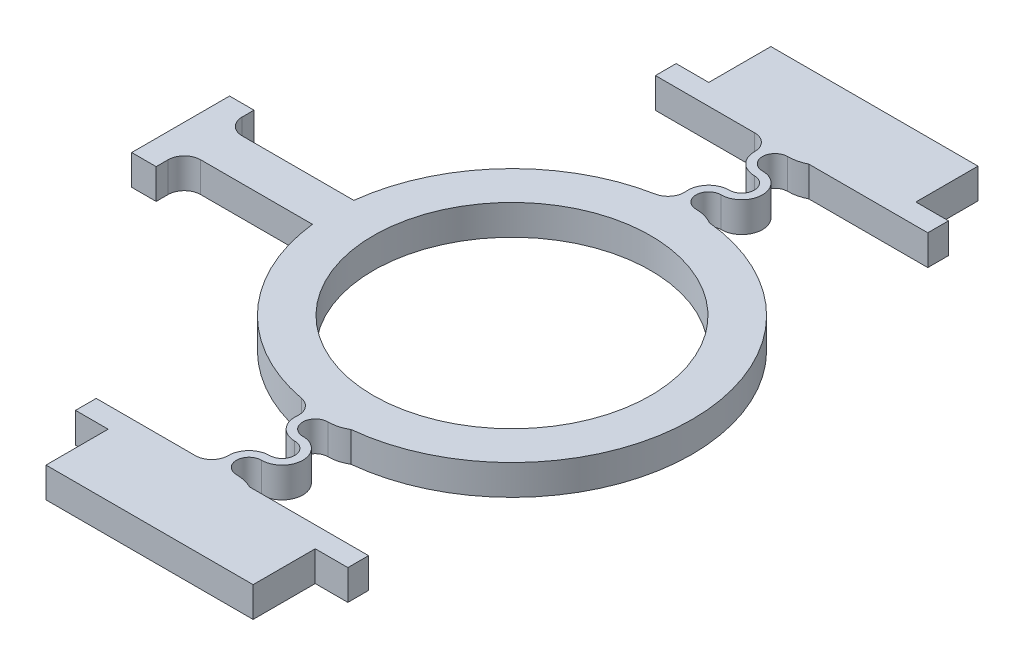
SolidWorks part; units mm, degrees
ref_plane "Front Plane" through (0, 0, 0) normal (0, 0, 1) x (1, 0, 0)
ref_plane "Top Plane" through (0, 0, 0) normal (0, 1, 0) x (1, 0, 0)
ref_plane "Right Plane" through (0, 0, 0) normal (1, 0, 0) x (0, 0, -1)
sketch "Sketch1" plane through (0, 0, 0) normal (0, 1, 0) x (1, 0, 0)
  line L5 (0, 19.685) -> (0, -19.685) construction
  line L7 (-0.2528, -17.145) -> (0.2528, -17.145)
  line L8 (-0.2528, -17.145) -> (-0.2528, -11.0371)
  line L9 (-0.2528, -11.0371) -> (0.2528, -11.0371)
  line L10 (0.2528, -17.145) -> (0.2528, -11.0371)
  line L11 (-0.2528, -17.145) -> (0.2528, -11.0371) construction
  line L12 (-0.2528, -11.0371) -> (0.2528, -17.145) construction
  line L13 (-6.35, 22.225) -> (6.35, 22.225)
  line L14 (-6.35, 22.225) -> (-6.35, 17.145)
  line L15 (-6.35, 17.145) -> (6.35, 17.145)
  line L16 (6.35, 22.225) -> (6.35, 17.145)
  line L17 (-6.35, 22.225) -> (6.35, 17.145) construction
  line L18 (-6.35, 17.145) -> (6.35, 22.225) construction
  line L19 (-6.35, -17.145) -> (6.35, -17.145)
  line L20 (-6.35, -17.145) -> (-6.35, -22.225)
  line L21 (-6.35, -22.225) -> (6.35, -22.225)
  line L22 (6.35, -17.145) -> (6.35, -22.225)
  line L23 (-6.35, -17.145) -> (6.35, -22.225) construction
  line L24 (-6.35, -22.225) -> (6.35, -17.145) construction
  line L25 (-20.32, 1.27) -> (-10.9667, 1.27)
  line L26 (-20.32, 1.27) -> (-20.32, -1.27)
  line L27 (-20.32, -1.27) -> (-10.9667, -1.27)
  line L28 (-10.9667, 1.27) -> (-10.9667, -1.27)
  line L29 (-20.32, 1.27) -> (-10.9667, -1.27) construction
  line L30 (-20.32, -1.27) -> (-10.9667, 1.27) construction
  circle A0 centre (0, 0) radius 8.5
  circle A1 centre (0, 0) radius 11.04
  arc A2 (0, 11.04) -> (0, 13.075) centre (0, 12.0575) cw construction
  arc A3 (0, 13.075) -> (0, 15.11) centre (0, 14.0925) ccw construction
  arc A10 (0, 15.11) -> (0, 17.145) centre (0, 16.1275) cw construction
  arc A11 (0, 11.29) -> (0, 12.825) centre (0, 12.0575) cw
  arc A12 (0, 12.825) -> (0, 15.36) centre (0, 14.0925) ccw
  arc A13 (0, 15.36) -> (0, 16.895) centre (0, 16.1275) cw
  arc A14 (-0.7228, 11.0163) -> (0, 13.325) centre (0, 12.0575) cw
  arc A15 (0, 13.325) -> (0, 14.86) centre (0, 14.0925) ccw
  arc A16 (0, 14.86) -> (-0.7558, 17.145) centre (0, 16.1275) cw
  arc A17 (0, 16.895) -> (1.0544, 17.145) centre (0, 19.2434) ccw
  arc A18 (0, 11.29) -> (1.1156, 10.9835) centre (0, 9.1065) cw
  arc A19 (0, 14.86) -> (0, 17.395) centre (0, 16.1275) cw construction
  arc A20 (0, 10.79) -> (0, 13.325) centre (0, 12.0575) cw construction
  point P9 (0, -14.0911)
  point P14 (0, 19.685)
  point P19 (0, -19.685)
  point P24 (-15.6434, 0)
  dimension "D1" = 17
  dimension "D2" = 2.54
  dimension "D3" = 0.25
  dimension "D4" = 12.7
  dimension "D5" = 5.08
  dimension "D6" = 44.45
  dimension "D7" = 2.54
  dimension "D8" = 20.32
  dimension "D9" = 0.25
sketch "Sketch2" plane through (0, 0, 0) normal (0, 1, 0) x (1, 0, 0)
  line L12 (-10.9667, 1.27) -> (-20.32, 1.27)
  line L13 (-10.9667, -1.27) -> (-10.9667, 1.27)
  line L14 (-20.32, -1.27) -> (-10.9667, -1.27)
  line L15 (-20.32, 1.27) -> (-20.32, -1.27)
  line L16 (-10.9667, 1.27) -> (-20.32, 1.27)
  line L18 (-20.32, -1.27) -> (-10.9667, -1.27)
  line L19 (-20.32, 1.27) -> (-20.32, -1.27)
  circle A2 centre (0, 0) radius 11.04
  arc A3 (-10.9667, -1.27) -> (-10.9667, 1.27) centre (0, 0) ccw
  circle A4 centre (0, 0) radius 8.5
  circle A10 centre (0, 0) radius 8.5
  dimension "D1" = 0
  dimension "D2" = 0
  dimension "D4" = 0
extrude "Boss-Extrude1" add sketch "Sketch2" along normal mid plane 1.85
sketch "Sketch7" plane through (0, 0.925, 0) normal (0, 1, 0) x (1, 0, 0)
  line L0 (1.0544, 17.145) -> (6.35, 17.145)
  line L28 (6.35, 22.225) -> (-6.35, 22.225)
  line L29 (6.35, 17.145) -> (6.35, 22.225)
  line L30 (-6.35, 17.145) -> (6.35, 17.145)
  line L31 (-6.35, 22.225) -> (-6.35, 17.145)
  line L32 (6.35, 22.225) -> (-6.35, 22.225)
  line L33 (6.35, 17.145) -> (6.35, 22.225)
  line L34 (-6.35, 17.145) -> (-0.7558, 17.145)
  line L35 (-6.35, 22.225) -> (-6.35, 17.145)
  arc A2 (0, 13.325) -> (-0.7228, 11.0163) centre (0, 12.0575) ccw construction
  circle A3 centre (0, 0) radius 11.04
  arc A4 (1.1156, 10.9835) -> (-0.7228, 11.0163) centre (0, 0) ccw
  arc A12 (0, 13.325) -> (0, 14.86) centre (0, 14.0925) ccw construction
  arc A13 (-0.7558, 17.145) -> (0, 14.86) centre (0, 16.1275) ccw construction
  arc A14 (0, 16.895) -> (1.0544, 17.145) centre (0, 19.2434) ccw construction
  arc A15 (0, 16.895) -> (0, 15.36) centre (0, 16.1275) ccw construction
  arc A16 (0, 12.825) -> (0, 15.36) centre (0, 14.0925) ccw construction
  arc A17 (0, 12.825) -> (0, 11.29) centre (0, 12.0575) ccw construction
  arc A18 (1.1156, 10.9835) -> (0, 11.29) centre (0, 9.1065) ccw construction
  arc A19 (0, 13.325) -> (-0.7228, 11.0163) centre (0, 12.0575) ccw
  arc A20 (0, 13.325) -> (0, 14.86) centre (0, 14.0925) ccw
  arc A21 (-0.7558, 17.145) -> (0, 14.86) centre (0, 16.1275) ccw
  arc A22 (0, 16.895) -> (1.0544, 17.145) centre (0, 19.2434) ccw
  arc A23 (0, 16.895) -> (0, 15.36) centre (0, 16.1275) ccw
  arc A24 (0, 12.825) -> (0, 15.36) centre (0, 14.0925) ccw
  arc A25 (0, 12.825) -> (0, 11.29) centre (0, 12.0575) ccw
  arc A26 (1.1156, 10.9835) -> (0, 11.29) centre (0, 9.1065) ccw
  dimension "D1" = 0
  dimension "D6" = 0
extrude "Boss-Extrude4" add sketch "Sketch7" against normal up to surface (1.85 mm away)
mirror "Mirror2" about plane through (0, 0, 0) normal (0, 0, 1) of "Boss-Extrude4"
fillet "Fillet3" radius 1 4 edges at (-0.7558, 0, 17.145) (-0.7228, 0, 11.0163) (-0.7228, 0, -11.0163) (-0.7558, 0, -17.145)
sketch "Sketch5" plane through (0, 0.925, 0) normal (0, 1, 0) x (1, 0, 0)
  line L1 (-8.35, 18.415) -> (8.35, 18.415)
  line L2 (-8.35, 18.415) -> (-8.35, 17.145)
  line L3 (-8.35, 17.145) -> (8.35, 17.145)
  line L4 (8.35, 18.415) -> (8.35, 17.145)
  line L5 (-8.35, 18.415) -> (8.35, 17.145) construction
  line L6 (-8.35, 17.145) -> (8.35, 18.415) construction
  line L10 (-6.35, 17.145) -> (-2.2674, 17.145) construction
  line L11 (6.35, 17.145) -> (6.35, 22.225) construction
  point P0 (0, 17.78)
  dimension "D1" = 2
  dimension "D2" = 1.27
extrude "Boss-Extrude3" add sketch "Sketch5" against normal up to surface (1.85 mm away)
mirror "Mirror1" about plane through (0, 0, 0) normal (0, 0, 1) of "Boss-Extrude3"
sketch "Sketch8" plane through (0, 0.925, 0) normal (0, 1, 0) x (1, 0, 0)
  line L0 (-20.32, 1.27) -> (-20.32, -1.27) construction
  line L1 (-18.82, 3) -> (-20.32, 3)
  line L2 (-18.82, 3) -> (-18.82, -3)
  line L3 (-18.82, -3) -> (-20.32, -3)
  line L4 (-20.32, 3) -> (-20.32, -3)
  line L5 (-18.82, 3) -> (-20.32, -3) construction
  line L6 (-18.82, -3) -> (-20.32, 3) construction
  point P0 (-19.57, 0)
  dimension "D1" = 1.5
  dimension "D2" = 6
extrude "Boss-Extrude5" add sketch "Sketch8" against normal up to surface (1.85 mm away)
fillet "Fillet4" radius 1 2 edges at (-18.82, 0, 1.27) (-18.82, 0, -1.27)
